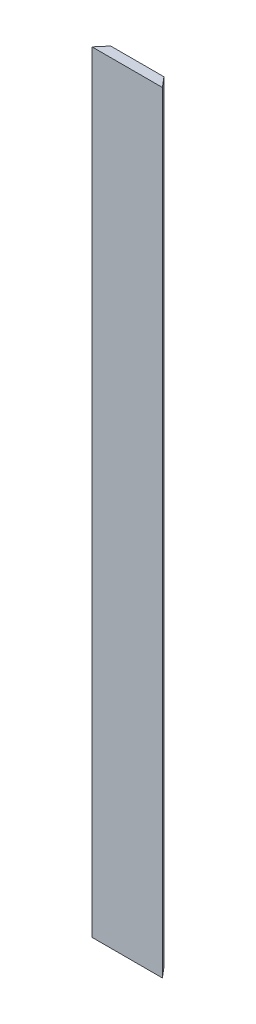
SolidWorks part; units mm, degrees
ref_plane "Front" through (0, 0, 0) normal (0, 0, 1) x (1, 0, 0)
ref_plane "Top" through (0, 0, 0) normal (0, 1, 0) x (1, 0, 0)
ref_plane "Right" through (0, 0, 0) normal (1, 0, 0) x (0, 0, -1)
sketch "Sketch1" plane through (0, 0, 0) normal (0, 1, 0) x (1, 0, 0)
  line L0 (0, 0) -> (111.125, 0)
  line L5 (111.125, 0) -> (97.6313, 15.875)
  line L6 (97.6313, 15.875) -> (13.4938, 15.875)
  line L7 (13.4938, 15.875) -> (0, 0)
  dimension "D1" = 111.125
  dimension "D2" = 84.1375
  dimension "D3" = 15.875
extrude "Boss-Extrude1" add sketch "Sketch1" along normal blind 1219.2
